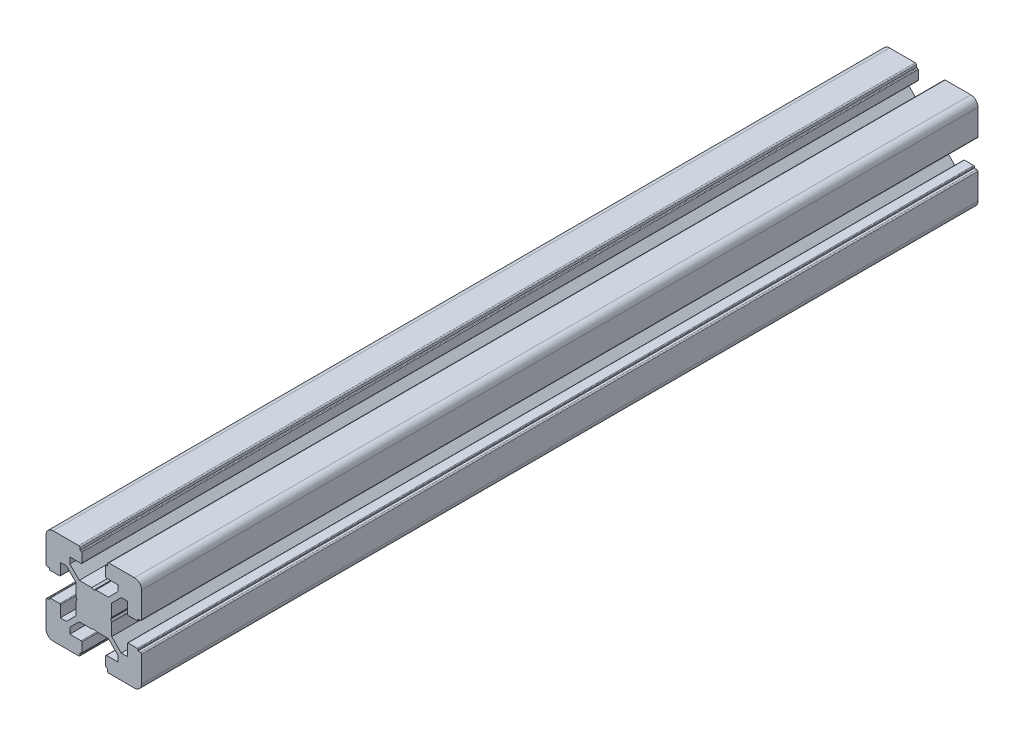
SolidWorks part; units mm, degrees
ref_plane "Front Plane" through (0, 0, 0) normal (0, 0, 1) x (1, 0, 0)
ref_plane "Top Plane" through (0, 0, 0) normal (0, 1, 0) x (1, 0, 0)
ref_plane "Right Plane" through (0, 0, 0) normal (1, 0, 0) x (0, 0, -1)
sketch "Sketch2" plane through (0, 0, 0) normal (0, 0, 1) x (1, 0, 0)
  line L72 (-20.3, 9.9499) -> (-20.3, 14.7)
  line L73 (-20.6, 15) -> (-24.5, 15)
  line L74 (-24.8, 14.7) -> (-24.8, 14.2)
  line L75 (-24.8, 14.2) -> (-25.8, 14.2)
  line L76 (-26.3, 13.7) -> (-26.3, 3)
  line L77 (-23.3, 0) -> (-12.6, 0)
  line L78 (-12.1, 0.5) -> (-12.1, 1.5)
  line L79 (-12.1, 1.5) -> (-11.6, 1.5)
  line L80 (-11.3, 1.8) -> (-11.3, 5.7)
  line L81 (-11.6, 6) -> (-16.3501, 6)
  line L82 (-16.3501, 6) -> (-16.3501, 8.5356)
  line L83 (-16.3501, 8.5356) -> (-12.3856, 12.5001)
  line L84 (-12.3856, 12.5001) -> (-7.166, 12.5001)
  line L85 (-7.166, 12.5001) -> (-6.3, 13.0001)
  line L86 (-6.3, 13.0001) -> (-5.4339, 12.5001)
  line L87 (-5.4339, 12.5001) -> (-0.2143, 12.5001)
  line L88 (-0.2143, 12.5001) -> (3.7501, 8.5357)
  line L89 (3.7501, 8.5357) -> (3.7501, 6)
  line L90 (3.7501, 6) -> (-1, 6)
  line L91 (-1.3, 5.7) -> (-1.3, 1.8)
  line L92 (-1, 1.5) -> (-0.5, 1.5)
  line L93 (-0.5, 1.5) -> (-0.5, 0.5)
  line L94 (0, 0) -> (10.7, 0)
  line L95 (13.7, 3) -> (13.7, 13.7)
  line L96 (13.2, 14.2) -> (12.2, 14.2)
  line L97 (12.2, 14.2) -> (12.2, 14.7)
  line L98 (11.9, 15) -> (8, 15)
  line L99 (7.7, 14.7) -> (7.7, 9.9498)
  line L100 (7.7, 9.9498) -> (5.1644, 9.9498)
  line L101 (5.1644, 9.9498) -> (1.1999, 13.9143)
  line L102 (1.1999, 13.9143) -> (1.1999, 19.134)
  line L103 (1.1999, 19.134) -> (0.6999, 20)
  line L104 (0.6999, 20) -> (1.1999, 20.866)
  line L105 (1.1999, 20.866) -> (1.1999, 26.0857)
  line L106 (1.1999, 26.0857) -> (5.1643, 30.0501)
  line L107 (5.1643, 30.0501) -> (7.7, 30.0501)
  line L108 (7.7, 30.0501) -> (7.7, 25.3)
  line L109 (8, 25) -> (11.9, 25)
  line L110 (12.2, 25.3) -> (12.2, 25.8)
  line L111 (12.2, 25.8) -> (13.2, 25.8)
  line L112 (13.7, 26.3) -> (13.7, 37)
  line L113 (10.7, 40) -> (0.0001, 40)
  line L114 (-0.4999, 39.5) -> (-0.4999, 38.5)
  line L115 (-0.4999, 38.5) -> (-0.9999, 38.5)
  line L116 (-1.2999, 38.2) -> (-1.2999, 34.3)
  line L117 (-0.9999, 34) -> (3.7502, 34)
  line L118 (3.7502, 34) -> (3.7502, 31.4644)
  line L119 (3.7502, 31.4644) -> (-0.2143, 27.4999)
  line L120 (-0.2143, 27.4999) -> (-5.4339, 27.4999)
  line L121 (-5.4339, 27.4999) -> (-6.3, 26.9999)
  line L122 (-6.3, 26.9999) -> (-7.166, 27.4999)
  line L123 (-7.166, 27.4999) -> (-12.3856, 27.4999)
  line L124 (-12.3856, 27.4999) -> (-16.3501, 31.4643)
  line L125 (-16.3501, 31.4643) -> (-16.3501, 34)
  line L126 (-16.3501, 34) -> (-11.5999, 34)
  line L127 (-11.2999, 34.3) -> (-11.2999, 38.2)
  line L128 (-11.5999, 38.5) -> (-12.0999, 38.5)
  line L129 (-12.0999, 38.5) -> (-12.0999, 39.5)
  line L130 (-12.5999, 40) -> (-23.3, 40)
  line L131 (-26.3, 37) -> (-26.3, 26.3)
  line L132 (-25.8, 25.8) -> (-24.8, 25.8)
  line L133 (-24.8, 25.8) -> (-24.8, 25.3)
  line L134 (-24.5, 25) -> (-20.6, 25)
  line L135 (-20.3, 25.3) -> (-20.3, 30.0502)
  line L136 (-20.3, 30.0502) -> (-17.7643, 30.0502)
  line L137 (-17.7643, 30.0502) -> (-13.7999, 26.0857)
  line L138 (-13.7999, 26.0857) -> (-13.7999, 20.866)
  line L139 (-13.7999, 20.866) -> (-13.2999, 20)
  line L140 (-13.2999, 20) -> (-13.7999, 19.134)
  line L141 (-13.7999, 19.134) -> (-13.7999, 13.9143)
  line L142 (-13.7999, 13.9143) -> (-17.7643, 9.9499)
  line L143 (-17.7643, 9.9499) -> (-20.3, 9.9499)
  line L144 (-20.3, 9.9499) -> (-20.3, 14.7)
  line L145 (-20.6, 15) -> (-24.5, 15)
  line L146 (-24.8, 14.7) -> (-24.8, 14.2)
  line L147 (-24.8, 14.2) -> (-25.8, 14.2)
  line L148 (-26.3, 13.7) -> (-26.3, 3)
  line L149 (-23.3, 0) -> (-12.6, 0)
  line L150 (-12.1, 0.5) -> (-12.1, 1.5)
  line L151 (-12.1, 1.5) -> (-11.6, 1.5)
  line L152 (-11.3, 1.8) -> (-11.3, 5.7)
  line L153 (-11.6, 6) -> (-16.3501, 6)
  line L154 (-16.3501, 6) -> (-16.3501, 8.5356)
  line L155 (-16.3501, 8.5356) -> (-12.3856, 12.5001)
  line L156 (-12.3856, 12.5001) -> (-7.166, 12.5001)
  line L157 (-7.166, 12.5001) -> (-6.3, 13.0001)
  line L158 (-6.3, 13.0001) -> (-5.4339, 12.5001)
  line L159 (-5.4339, 12.5001) -> (-0.2143, 12.5001)
  line L160 (-0.2143, 12.5001) -> (3.7501, 8.5357)
  line L161 (3.7501, 8.5357) -> (3.7501, 6)
  line L162 (3.7501, 6) -> (-1, 6)
  line L163 (-1.3, 5.7) -> (-1.3, 1.8)
  line L164 (-1, 1.5) -> (-0.5, 1.5)
  line L165 (-0.5, 1.5) -> (-0.5, 0.5)
  line L166 (0, 0) -> (10.7, 0)
  line L167 (13.7, 3) -> (13.7, 13.7)
  line L168 (13.2, 14.2) -> (12.2, 14.2)
  line L169 (12.2, 14.2) -> (12.2, 14.7)
  line L170 (11.9, 15) -> (8, 15)
  line L171 (7.7, 14.7) -> (7.7, 9.9498)
  line L172 (7.7, 9.9498) -> (5.1644, 9.9498)
  line L173 (5.1644, 9.9498) -> (1.1999, 13.9143)
  line L174 (1.1999, 13.9143) -> (1.1999, 19.134)
  line L175 (1.1999, 19.134) -> (0.6999, 20)
  line L176 (0.6999, 20) -> (1.1999, 20.866)
  line L177 (1.1999, 20.866) -> (1.1999, 26.0857)
  line L178 (1.1999, 26.0857) -> (5.1643, 30.0501)
  line L179 (5.1643, 30.0501) -> (7.7, 30.0501)
  line L180 (7.7, 30.0501) -> (7.7, 25.3)
  line L181 (8, 25) -> (11.9, 25)
  line L182 (12.2, 25.3) -> (12.2, 25.8)
  line L183 (12.2, 25.8) -> (13.2, 25.8)
  line L184 (13.7, 26.3) -> (13.7, 37)
  line L185 (10.7, 40) -> (0.0001, 40)
  line L186 (-0.4999, 39.5) -> (-0.4999, 38.5)
  line L187 (-0.4999, 38.5) -> (-0.9999, 38.5)
  line L188 (-1.2999, 38.2) -> (-1.2999, 34.3)
  line L189 (-0.9999, 34) -> (3.7502, 34)
  line L190 (3.7502, 34) -> (3.7502, 31.4644)
  line L191 (3.7502, 31.4644) -> (-0.2143, 27.4999)
  line L192 (-0.2143, 27.4999) -> (-5.4339, 27.4999)
  line L193 (-5.4339, 27.4999) -> (-6.3, 26.9999)
  line L194 (-6.3, 26.9999) -> (-7.166, 27.4999)
  line L195 (-7.166, 27.4999) -> (-12.3856, 27.4999)
  line L196 (-12.3856, 27.4999) -> (-16.3501, 31.4643)
  line L197 (-16.3501, 31.4643) -> (-16.3501, 34)
  line L198 (-16.3501, 34) -> (-11.5999, 34)
  line L199 (-11.2999, 34.3) -> (-11.2999, 38.2)
  line L200 (-11.5999, 38.5) -> (-12.0999, 38.5)
  line L201 (-12.0999, 38.5) -> (-12.0999, 39.5)
  line L202 (-12.5999, 40) -> (-23.3, 40)
  line L203 (-26.3, 37) -> (-26.3, 26.3)
  line L204 (-25.8, 25.8) -> (-24.8, 25.8)
  line L205 (-24.8, 25.8) -> (-24.8, 25.3)
  line L206 (-24.5, 25) -> (-20.6, 25)
  line L207 (-20.3, 25.3) -> (-20.3, 30.0502)
  line L208 (-20.3, 30.0502) -> (-17.7643, 30.0502)
  line L209 (-17.7643, 30.0502) -> (-13.7999, 26.0857)
  line L210 (-13.7999, 26.0857) -> (-13.7999, 20.866)
  line L211 (-13.7999, 20.866) -> (-13.2999, 20)
  line L212 (-13.2999, 20) -> (-13.7999, 19.134)
  line L213 (-13.7999, 19.134) -> (-13.7999, 13.9143)
  line L214 (-13.7999, 13.9143) -> (-17.7643, 9.9499)
  line L215 (-17.7643, 9.9499) -> (-20.3, 9.9499)
  arc A28 (-20.3, 14.7) -> (-20.6, 15) centre (-20.6, 14.7) ccw
  arc A29 (-24.5, 15) -> (-24.8, 14.7) centre (-24.5, 14.7) ccw
  arc A30 (-25.8, 14.2) -> (-26.3, 13.7) centre (-25.8, 13.7) ccw
  arc A31 (-26.3, 3) -> (-23.3, 0) centre (-23.3, 3) ccw
  arc A32 (-12.6, 0) -> (-12.1, 0.5) centre (-12.6, 0.5) ccw
  arc A33 (-11.6, 1.5) -> (-11.3, 1.8) centre (-11.6, 1.8) ccw
  arc A34 (-11.3, 5.7) -> (-11.6, 6) centre (-11.6, 5.7) ccw
  arc A35 (-1, 6) -> (-1.3, 5.7) centre (-1, 5.7) ccw
  arc A36 (-1.3, 1.8) -> (-1, 1.5) centre (-1, 1.8) ccw
  arc A37 (-0.5, 0.5) -> (0, 0) centre (0, 0.5) ccw
  arc A38 (10.7, 0) -> (13.7, 3) centre (10.7, 3) ccw
  arc A39 (13.7, 13.7) -> (13.2, 14.2) centre (13.2, 13.7) ccw
  arc A40 (12.2, 14.7) -> (11.9, 15) centre (11.9, 14.7) ccw
  arc A41 (8, 15) -> (7.7, 14.7) centre (8, 14.7) ccw
  arc A42 (7.7, 25.3) -> (8, 25) centre (8, 25.3) ccw
  arc A43 (11.9, 25) -> (12.2, 25.3) centre (11.9, 25.3) ccw
  arc A44 (13.2, 25.8) -> (13.7, 26.3) centre (13.2, 26.3) ccw
  arc A45 (13.7, 37) -> (10.7, 40) centre (10.7, 37) ccw
  arc A46 (0.0001, 40) -> (-0.4999, 39.5) centre (0.0001, 39.5) ccw
  arc A47 (-0.9999, 38.5) -> (-1.2999, 38.2) centre (-0.9999, 38.2) ccw
  arc A48 (-1.2999, 34.3) -> (-0.9999, 34) centre (-0.9999, 34.3) ccw
  arc A49 (-11.5999, 34) -> (-11.2999, 34.3) centre (-11.5999, 34.3) ccw
  arc A50 (-11.2999, 38.2) -> (-11.5999, 38.5) centre (-11.5999, 38.2) ccw
  arc A51 (-12.0999, 39.5) -> (-12.5999, 40) centre (-12.5999, 39.5) ccw
  arc A52 (-23.3, 40) -> (-26.3, 37) centre (-23.3, 37) ccw
  arc A53 (-26.3, 26.3) -> (-25.8, 25.8) centre (-25.8, 26.3) ccw
  arc A54 (-24.8, 25.3) -> (-24.5, 25) centre (-24.5, 25.3) ccw
  arc A55 (-20.6, 25) -> (-20.3, 25.3) centre (-20.6, 25.3) ccw
  arc A56 (-20.3, 14.7) -> (-20.6, 15) centre (-20.6, 14.7) ccw
  arc A57 (-24.5, 15) -> (-24.8, 14.7) centre (-24.5, 14.7) ccw
  arc A58 (-25.8, 14.2) -> (-26.3, 13.7) centre (-25.8, 13.7) ccw
  arc A59 (-26.3, 3) -> (-23.3, 0) centre (-23.3, 3) ccw
  arc A60 (-12.6, 0) -> (-12.1, 0.5) centre (-12.6, 0.5) ccw
  arc A61 (-11.6, 1.5) -> (-11.3, 1.8) centre (-11.6, 1.8) ccw
  arc A62 (-11.3, 5.7) -> (-11.6, 6) centre (-11.6, 5.7) ccw
  arc A63 (-1, 6) -> (-1.3, 5.7) centre (-1, 5.7) ccw
  arc A64 (-1.3, 1.8) -> (-1, 1.5) centre (-1, 1.8) ccw
  arc A65 (-0.5, 0.5) -> (0, 0) centre (0, 0.5) ccw
  arc A66 (10.7, 0) -> (13.7, 3) centre (10.7, 3) ccw
  arc A67 (13.7, 13.7) -> (13.2, 14.2) centre (13.2, 13.7) ccw
  arc A68 (12.2, 14.7) -> (11.9, 15) centre (11.9, 14.7) ccw
  arc A69 (8, 15) -> (7.7, 14.7) centre (8, 14.7) ccw
  arc A70 (7.7, 25.3) -> (8, 25) centre (8, 25.3) ccw
  arc A71 (11.9, 25) -> (12.2, 25.3) centre (11.9, 25.3) ccw
  arc A72 (13.2, 25.8) -> (13.7, 26.3) centre (13.2, 26.3) ccw
  arc A73 (13.7, 37) -> (10.7, 40) centre (10.7, 37) ccw
  arc A74 (0.0001, 40) -> (-0.4999, 39.5) centre (0.0001, 39.5) ccw
  arc A75 (-0.9999, 38.5) -> (-1.2999, 38.2) centre (-0.9999, 38.2) ccw
  arc A76 (-1.2999, 34.3) -> (-0.9999, 34) centre (-0.9999, 34.3) ccw
  arc A77 (-11.5999, 34) -> (-11.2999, 34.3) centre (-11.5999, 34.3) ccw
  arc A78 (-11.2999, 38.2) -> (-11.5999, 38.5) centre (-11.5999, 38.2) ccw
  arc A79 (-12.0999, 39.5) -> (-12.5999, 40) centre (-12.5999, 39.5) ccw
  arc A80 (-23.3, 40) -> (-26.3, 37) centre (-23.3, 37) ccw
  arc A81 (-26.3, 26.3) -> (-25.8, 25.8) centre (-25.8, 26.3) ccw
  arc A82 (-24.8, 25.3) -> (-24.5, 25) centre (-24.5, 25.3) ccw
  arc A83 (-20.6, 25) -> (-20.3, 25.3) centre (-20.6, 25.3) ccw
  dimension "D1" = 0
extrude "Boss-Extrude1" add sketch "Sketch2" along normal blind 350 contours L185 A74 L186 L187 A75 L188 A76 L189 L190 L191 L192 L193 L194 L195 L196 L197 L198 A77 L199 A78 L200 L201 A79 L202 A80 L203 A81 L204 L205 A82 L206 A83 L207 L208 L209 L210 L211 L212 L213 L214 L215 L144 A56 L145 A57 L146 L147 A58 L148 A59 L149 A60 L150 L151 A61 L152 A62 L153 L154 L155 L156 L157 L158 L159 L160 L161 L162 A63 L163 A64 L164 L165 A65 L166 A66 L167 A67 L168 L169 A68 L170 A69 L171 L172 L173 L174 L175 L176 L177 L178 L179 L180 A70 L181 A71 L182 L183 A72 L184 A73
